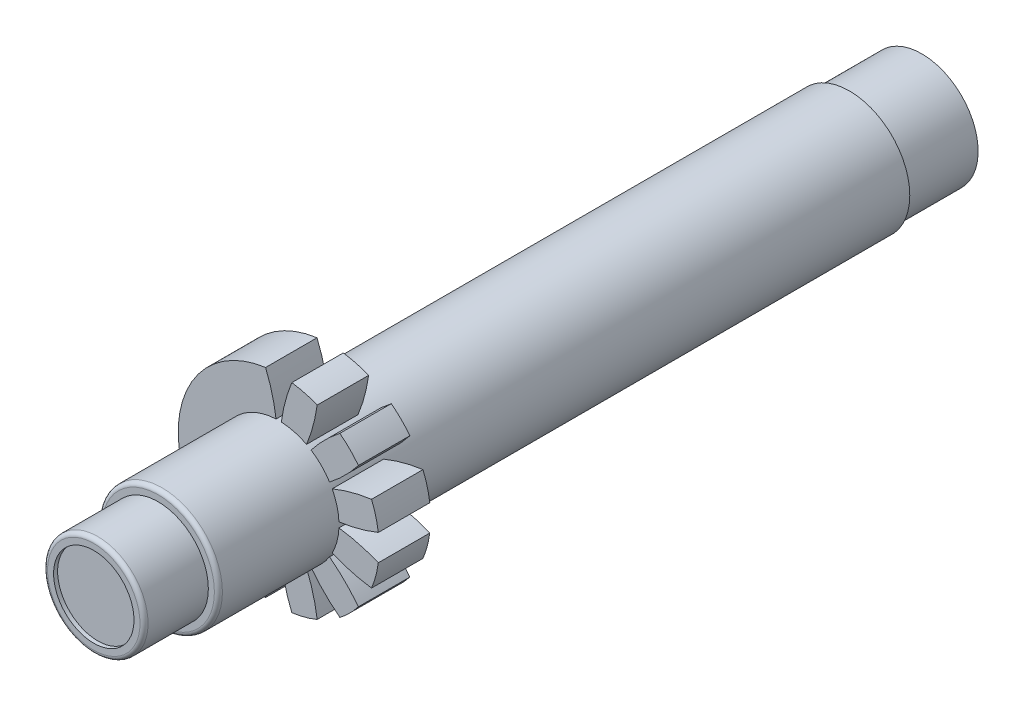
SolidWorks part; units mm, degrees
ref_plane "Plane1" through (0, 0, 0) normal (0, 0, 1) x (1, 0, 0)
ref_plane "Plane2" through (0, 0, 0) normal (0, 1, 0) x (1, 0, 0)
ref_plane "Plane3" through (0, 0, 0) normal (1, 0, 0) x (0, 0, -1)
sketch "Sketch1" plane through (0, 0, 0) normal (0, 0, 1) x (1, 0, 0)
  circle A0 centre (0, 0) radius 3.81
  dimension "D1" = 7.62
extrude "Base-Extrude" add sketch "Sketch1" against normal blind 48.26
sketch "Sketch2" plane through (0, 0, 0) normal (0, 0, 1) x (1, 0, 0)
  circle A1 centre (0, 0) radius 3.175
  circle A2 centre (0, 0) radius 3.175
  dimension "D1" = 0.635
extrude "Boss-Extrude1" add sketch "Sketch2" along normal blind 4.064
sketch "Sketch3" plane through (0, 0, 4.064) normal (0, 0, 1) x (1, 0, 0)
  circle A1 centre (0, 0) radius 2.54
  circle A2 centre (0, 0) radius 2.54
  dimension "D1" = 0.635
extrude "Cut-Extrude1" cut sketch "Sketch3" against normal blind 0.254
fillet "Fillet1" radius 0.254
sketch "Sketch4" plane through (0, 0, -48.26) normal (0, 0, -1) x (-1, 0, 0)
  circle A1 centre (0, 0) radius 3.556
  circle A2 centre (0, 0) radius 3.556
  circle A3 centre (0, 0) radius 4.064
  circle A4 centre (0, 0) radius 4.064
  dimension "D2" = 0.254
  dimension "D1" = 0.254
extrude "Cut-Extrude2" cut sketch "Sketch4" against normal blind 4.572
sketch "Sketch5" plane through (0, 0, -48.26) normal (0, 0, -1) x (-1, 0, 0)
  line L0 (-3.2922, 0.254) -> (3.2922, 0.254)
  line L2 (3.2922, -0.254) -> (-3.2922, -0.254)
  arc A0 (3.2922, -0.254) -> (3.2922, 0.254) centre (0, 0) ccw
  circle A1 centre (0, 0) radius 3.302
  arc A2 (-3.2922, 0.254) -> (-3.2922, -0.254) centre (0, 0) ccw
  dimension "D2" = 0.508
  dimension "D1" = 0.254
extrude "Cut-Extrude3" cut sketch "Sketch5" against normal blind 4.572
ref_plane "Plane4" through (0, 0, -7.62) normal (0, 0, 1) x (1, 0, 0)
sketch "Sketch7" plane through (0, 0, -7.62) normal (0, 0, 1) x (1, 0, 0)
  circle A0 centre (0, 0) radius 6.35
  dimension "D1" = 12.7
extrude "Boss-Extrude2" add sketch "Sketch7" against normal blind 3.2512
sketch "Sketch9" plane through (0, 0, -7.62) normal (0, 0, 1) x (1, 0, 0)
  line L0 (0, 6.35) -> (0, 0) construction
  line L1 (0, 0) -> (9.6524, 0) construction
  line L2 (0, 0) -> (-0.8288, 6.2957) construction
  line L3 (0, 0) -> (0.8288, 6.2957) construction
  line L4 (0, 0) -> (0.1662, 3.8064) construction
  line L5 (0, 0) -> (-0.1662, 3.8064) construction
  circle A0 centre (0, 0) radius 6.35 construction
  arc A1 (0.8288, 6.2957) -> (-0.8288, 6.2957) centre (0, 0) ccw
  arc A2 (0.8288, 6.2957) -> (0.1662, 3.8064) centre (10.0805, 2.5) ccw
  arc A3 (-0.8288, 6.2957) -> (-0.1662, 3.8064) centre (-10.0805, 2.5) cw
  arc A4 (-0.1662, 3.8064) -> (0.1662, 3.8064) centre (0, 0) cw
  dimension "D2" = 10
  dimension "D1" = 7.62
  dimension "D3" = 90
  dimension "D4" = 15
  dimension "D5" = 5
extrude "Cut-Extrude4" cut sketch "Sketch9" against normal through all
pattern_circular "CirPattern1" count 9 every 30
